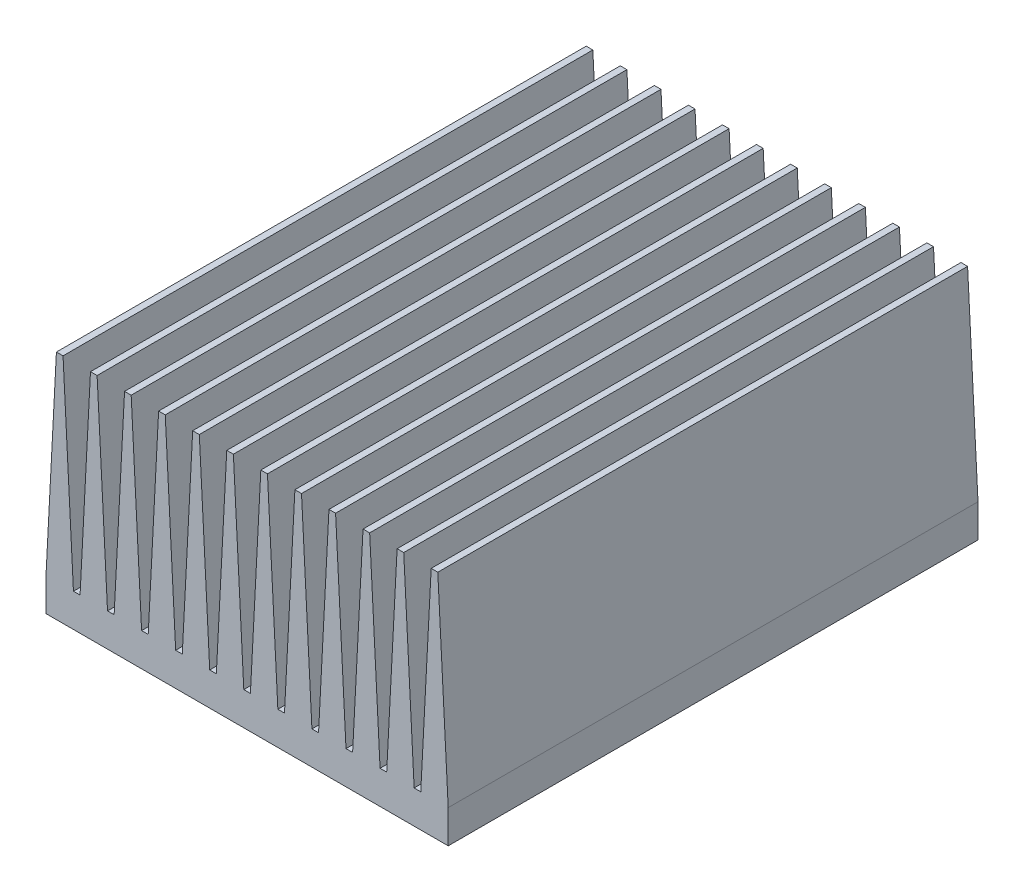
SolidWorks part; units mm, degrees
ref_plane "Front Plane" through (0, 0, 0) normal (0, 0, 1) x (1, 0, 0)
ref_plane "Top Plane" through (0, 0, 0) normal (0, 1, 0) x (1, 0, 0)
ref_plane "Right Plane" through (0, 0, 0) normal (1, 0, 0) x (0, 0, -1)
sketch "Sketch1" plane through (0, 0, 0) normal (0, 0, 1) x (1, 0, 0)
  line L0 (-30.3668, 0) -> (30.3668, 0)
  line L1 (30.3668, 0) -> (30.3668, 5)
  line L2 (26.2223, 5) -> (25.2223, 5)
  line L3 (-30.3668, 5) -> (-30.3668, 0)
  line L4 (30.3668, 5) -> (28.7946, 35)
  line L5 (28.7946, 35) -> (27.7946, 35)
  line L6 (27.7946, 35) -> (26.2223, 5)
  line L7 (25.2223, 5) -> (23.6501, 35)
  line L8 (23.6501, 35) -> (22.6501, 35)
  line L9 (22.6501, 35) -> (21.0779, 5)
  line L10 (20.0779, 5) -> (18.5056, 35)
  line L11 (18.5056, 35) -> (17.5056, 35)
  line L12 (17.5056, 35) -> (15.9334, 5)
  line L13 (14.9334, 5) -> (13.3612, 35)
  line L14 (13.3612, 35) -> (12.3612, 35)
  line L15 (12.3612, 35) -> (10.7889, 5)
  line L16 (9.7889, 5) -> (8.2167, 35)
  line L17 (8.2167, 35) -> (7.2167, 35)
  line L18 (7.2167, 35) -> (5.6445, 5)
  line L19 (4.6445, 5) -> (3.0722, 35)
  line L20 (3.0722, 35) -> (2.0722, 35)
  line L21 (2.0722, 35) -> (0.5, 5)
  line L22 (-0.5, 5) -> (-2.0722, 35)
  line L23 (-2.0722, 35) -> (-3.0722, 35)
  line L24 (-3.0722, 35) -> (-4.6445, 5)
  line L25 (-5.6445, 5) -> (-7.2167, 35)
  line L26 (-7.2167, 35) -> (-8.2167, 35)
  line L27 (-8.2167, 35) -> (-9.7889, 5)
  line L28 (-10.7889, 5) -> (-12.3612, 35)
  line L29 (-12.3612, 35) -> (-13.3612, 35)
  line L30 (-13.3612, 35) -> (-14.9334, 5)
  line L31 (-15.9334, 5) -> (-17.5056, 35)
  line L32 (-17.5056, 35) -> (-18.5056, 35)
  line L33 (-18.5056, 35) -> (-20.0779, 5)
  line L34 (-21.0779, 5) -> (-22.6501, 35)
  line L35 (-22.6501, 35) -> (-23.6501, 35)
  line L36 (-23.6501, 35) -> (-25.2223, 5)
  line L37 (-26.2223, 5) -> (-27.7946, 35)
  line L38 (-27.7946, 35) -> (-28.7946, 35)
  line L39 (-28.7946, 35) -> (-30.3668, 5)
  line L40 (21.0779, 5) -> (20.0779, 5)
  line L41 (15.9334, 5) -> (14.9334, 5)
  line L42 (10.7889, 5) -> (9.7889, 5)
  line L43 (5.6445, 5) -> (4.6445, 5)
  line L44 (0.5, 5) -> (-0.5, 5)
  line L45 (-4.6445, 5) -> (-5.6445, 5)
  line L46 (-9.7889, 5) -> (-10.7889, 5)
  line L47 (-14.9334, 5) -> (-15.9334, 5)
  line L48 (-20.0779, 5) -> (-21.0779, 5)
  line L49 (-25.2223, 5) -> (-26.2223, 5)
  point P3 (0, 0)
  point P4 (0, 0)
extrude "Boss-Extrude1" add sketch "Sketch1" along normal blind 80
equation "\"A\"= 35"
equation "\"B\"= 80"
equation "\"C\"= 1"
equation "\"D3@Sketch1\"=\"C\""
equation "\"D7@Sketch1\"=\"C\""
equation "\"D8@Sketch1\"=\"C\""
equation "\"D9@Sketch1\"=\"A\""
equation "\"D10@Sketch1\"=\"A\""
equation "\"D1@Boss-Extrude1\"=\"B\""
